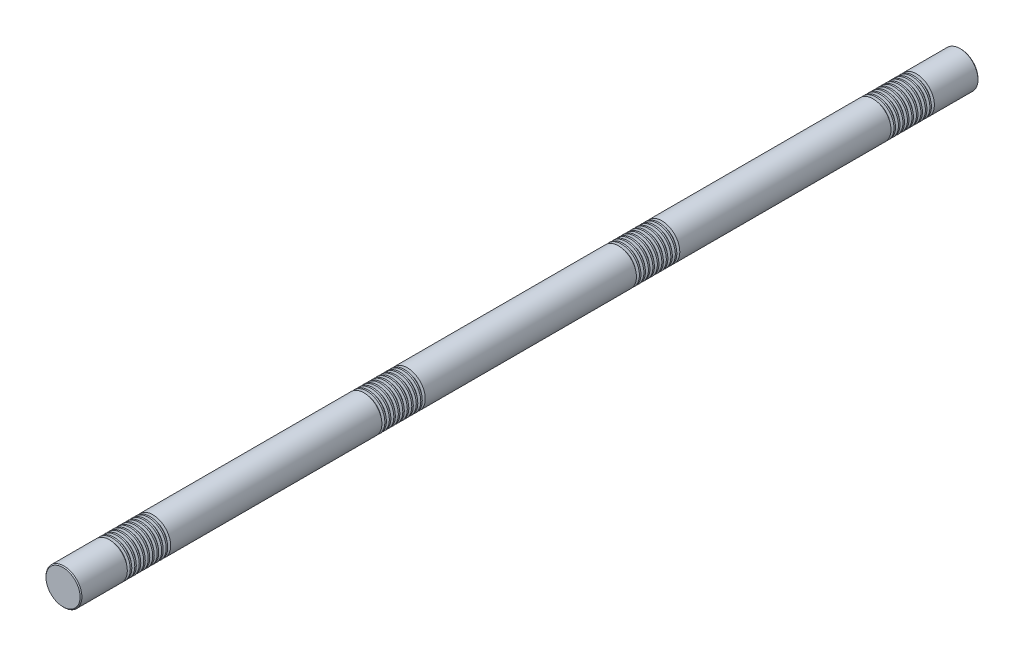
SolidWorks part; units mm, degrees
ref_plane "Front Plane" through (0, 0, 0) normal (0, 0, 1) x (1, 0, 0)
ref_plane "Top Plane" through (0, 0, 0) normal (0, 1, 0) x (1, 0, 0)
ref_plane "Right Plane" through (0, 0, 0) normal (1, 0, 0) x (0, 0, -1)
sketch "Sketch1" plane through (0, 0, 0) normal (0, 0, 1) x (1, 0, 0)
  circle A0 centre (0, 0) radius 40
  dimension "D1" = 80
extrude "Boss-Extrude1" add sketch "Sketch1" along normal mid plane 2000
chamfer "Chamfer1" distance 2 angle 45 2 edges at (40, 0, -1000) (40, 0, 1000)
sketch "Sketch2" plane through (0, 0, 0) normal (1, 0, 0) x (0, 0, -1)
  line L0 (900.8038, 40) -> (894.1962, 40)
  line L1 (998, 40) -> (-998, 40) construction
  line L2 (894.1962, 40) -> (895.8038, 34)
  line L3 (895.8038, 34) -> (899.1962, 34)
  line L4 (899.1962, 34) -> (900.8038, 40)
  line L5 (1000, -38) -> (1000, 38) construction
  point P4 (897.5, 40)
  point P7 (897.5, 34)
  point P8 (900, 37)
  point P9 (895, 37)
  dimension "D1" = 5
  dimension "D2" = 100
  dimension "D3" = 6
  dimension "D4" = 30
revolve "Cut-Revolve1" cut sketch "Sketch2" angle 360 about axis through (0, 0, 1000) along (0, 0, -1)
pattern_linear "LPattern1" count 10 spacing 10 along (0, 0, 1) of "Cut-Revolve1"
pattern_linear "LPattern2" count 4 spacing 567 along (0, 0, 1) of "Cut-Revolve1", "LPattern1"
